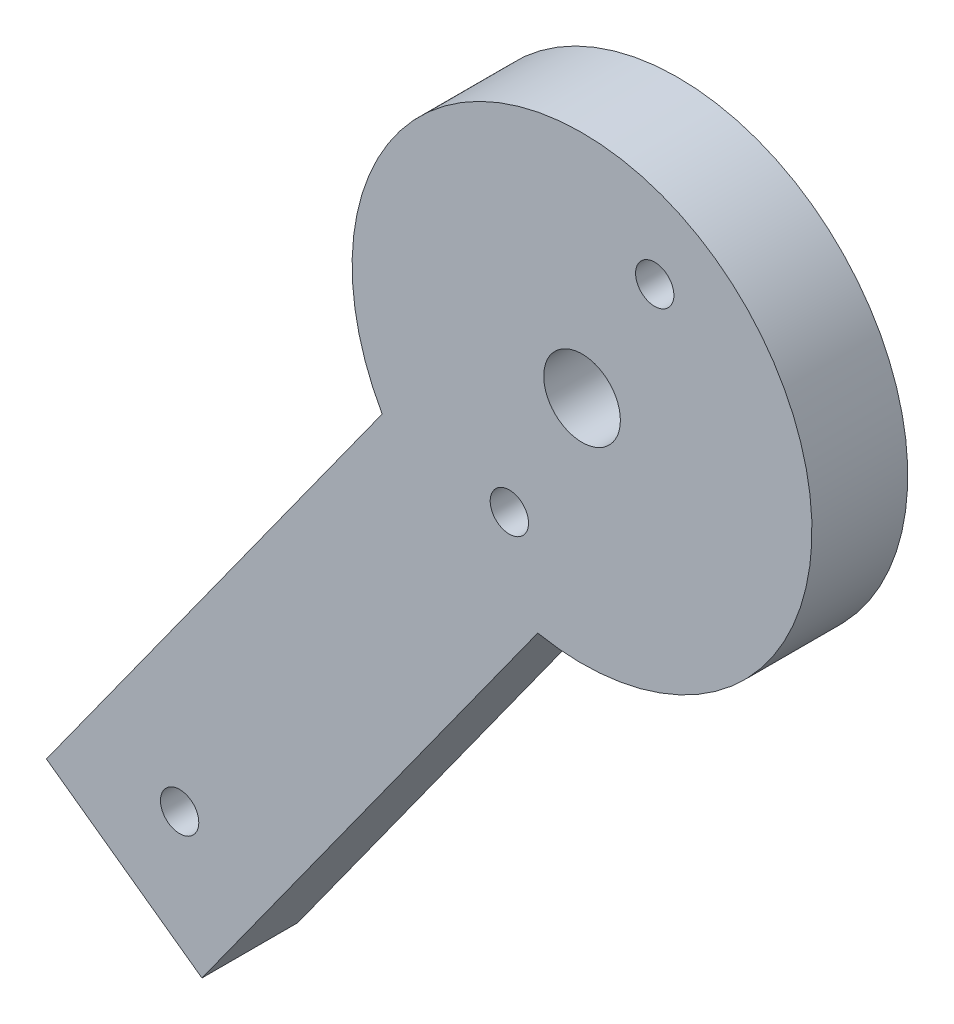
SolidWorks part; units mm, degrees
ref_plane "Front Plane" through (0, 0, 0) normal (0, 0, 1) x (1, 0, 0)
ref_plane "Top Plane" through (0, 0, 0) normal (0, 1, 0) x (1, 0, 0)
ref_plane "Right Plane" through (0, 0, 0) normal (1, 0, 0) x (0, 0, -1)
sketch "Sketch1" plane through (0, 0, 0) normal (0, 0, 1) x (1, 0, 0)
  line L0 (0, 0) -> (9.4334, 0) construction
  line L1 (0, 0) -> (-5.4416, -7.5618) construction
  line L3 (-10.4302, -5.9339) -> (-27.9532, -30.2844)
  line L4 (-27.9532, -30.2844) -> (-19.8364, -36.1254)
  line L5 (-2.3134, -11.7749) -> (-19.8364, -36.1254)
  arc A0 (-2.3134, -11.7749) -> (-10.4302, -5.9339) centre (0, 0) ccw
  dimension "D1" = 234.261
  dimension "D2" = 30
  dimension "D6" = 10
extrude "Boss-Extrude1" add sketch "Sketch1" along normal blind 5
sketch "Sketch2" plane through (0, 0, 5) normal (0, 0, 1) x (1, 0, 0)
  line L0 (0, 0) -> (-23.8948, -33.2049) construction
  line L1 (-27.9532, -30.2844) -> (-19.8364, -36.1254) construction
  circle A0 centre (0, 0) radius 2
  circle A1 centre (-21.0015, -29.1843) radius 1
  dimension "D1" = 35.9554
extrude "Cut-Extrude1" cut sketch "Sketch2" against normal blind 5
sketch "Sketch3" plane through (0, 0, 5) normal (0, 0, 1) x (1, 0, 0)
  line L0 (0, 0) -> (8.8397, 0) construction
  line L1 (0, 0) -> (3.3522, 6.2251) construction
  line L2 (0, 0) -> (-4.1653, -7.7351) construction
  circle A0 centre (3.793, 7.0437) radius 1
  circle A1 centre (-3.793, -7.0437) radius 1
  circle A2 centre (0, 0) radius 2 construction
  dimension "D3" = 8
  dimension "D4" = 8
  dimension "D1" = 61.698
  dimension "D2" = 180
extrude "Cut-Extrude2" cut sketch "Sketch3" against normal blind 5
sketch "Sketch4" plane through (0, 0, 5) normal (0, 0, 1) x (1, 0, 0)
  line L0 (0, 0) -> (8.8397, 0)
